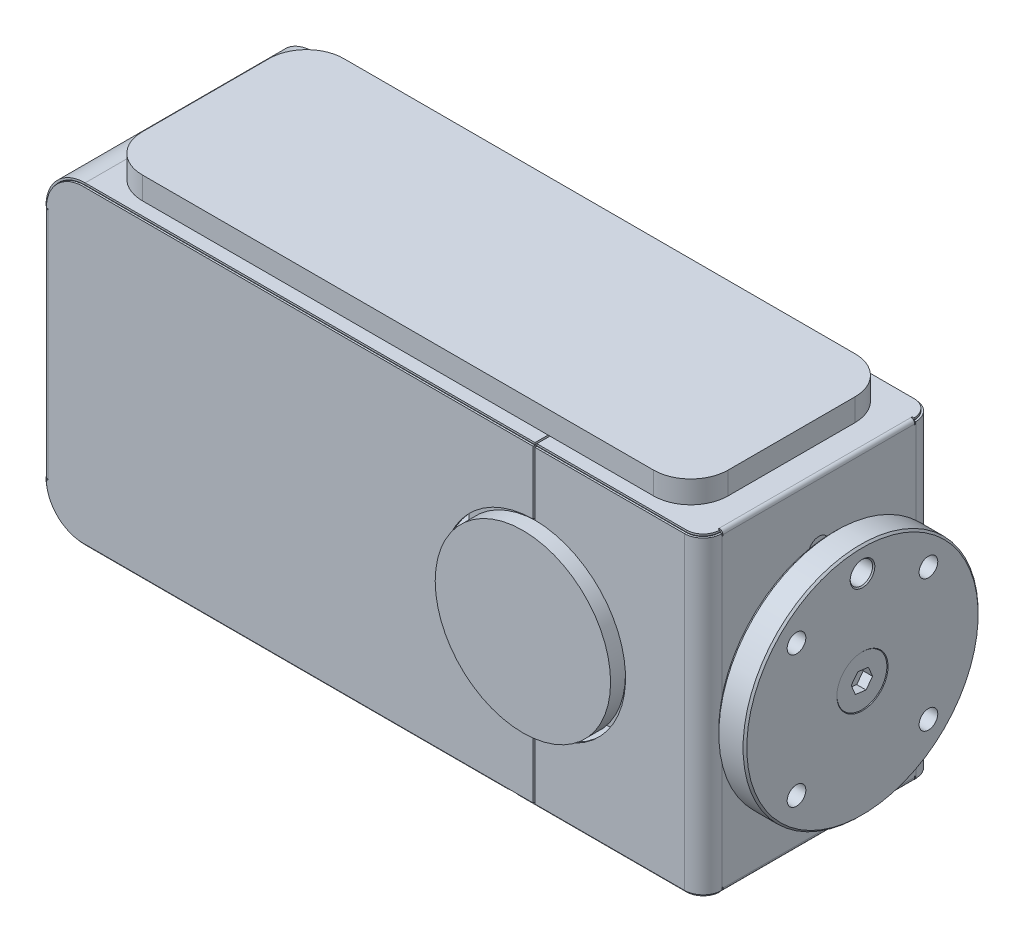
SolidWorks part; units mm, degrees
ref_plane "Ebene vorne" through (0, 0, 0) normal (0, 0, 1) x (1, 0, 0)
ref_plane "Ebene oben" through (0, 0, 0) normal (0, 1, 0) x (1, 0, 0)
ref_plane "Ebene rechts" through (0, 0, 0) normal (1, 0, 0) x (0, 0, -1)
imported_body "Defeature ausgeführt1"
imported_body "Defeature ausgeführt2"
imported_body "Defeature ausgeführt3"
imported_body "Defeature ausgeführt4"
imported_body "Defeature ausgeführt5"
imported_body "Defeature ausgeführt6"
imported_body "Defeature ausgeführt7" [suppressed]
imported_body "Defeature ausgeführt8" [suppressed]
imported_body "Defeature ausgeführt9"
imported_body "Defeature ausgeführt10"
imported_body "Defeature ausgeführt11"
imported_body "Defeature ausgeführt12"
imported_body "Defeature ausgeführt13"
imported_body "Defeature ausgeführt14"
imported_body "Defeature ausgeführt15"
other "Fläche löschen1"
delete or keep bodies "Körper-Löschen/beibehalten 1" [suppressed] type delete bodies bodies 112 117
delete or keep bodies "Körper-Löschen/beibehalten 2" [suppressed] type keep bodies bodies 112 117
